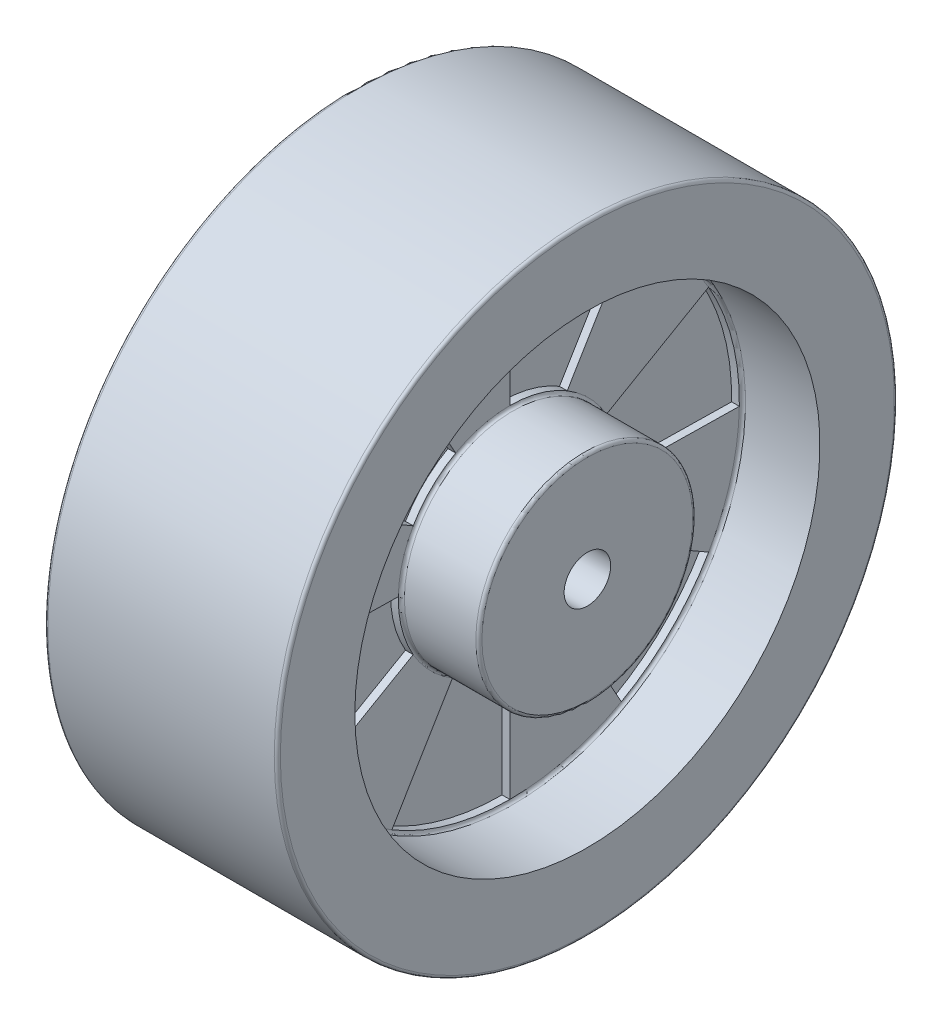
SolidWorks part; units mm, degrees
ref_plane "Front Plane" through (0, 0, 0) normal (0, 0, 1) x (1, 0, 0)
ref_plane "Top Plane" through (0, 0, 0) normal (0, 1, 0) x (1, 0, 0)
ref_plane "Right Plane" through (0, 0, 0) normal (1, 0, 0) x (0, 0, -1)
sketch "Sketch1" plane through (0, 0, 0) normal (0, 0, 1) x (1, 0, 0)
  line L0 (0, 0) -> (56.1842, 0) construction
  line L1 (-38.1, 7.62) -> (38.1, 7.62)
  line L2 (38.1, 7.62) -> (38.1, 35.56)
  line L3 (38.1, 35.56) -> (12.7, 35.56)
  line L4 (12.7, 35.56) -> (12.7, 76.2)
  line L5 (12.7, 76.2) -> (38.1, 76.2)
  line L6 (38.1, 76.2) -> (38.1, 101.6)
  line L7 (38.1, 101.6) -> (-38.1, 101.6)
  line L8 (-38.1, 101.6) -> (-38.1, 76.2)
  line L9 (-38.1, 76.2) -> (-12.7, 76.2)
  line L10 (-12.7, 76.2) -> (-12.7, 35.56)
  line L11 (-12.7, 35.56) -> (-38.1, 35.56)
  line L12 (-38.1, 35.56) -> (-38.1, 7.62)
  line L13 (0, 0) -> (0, 30.585) construction
  point P15 (0, 7.62)
  dimension "D1" = 7.62
  dimension "D2" = 35.56
  dimension "D3" = 76.2
  dimension "D4" = 101.6
  dimension "D5" = 76.2
  dimension "D6" = 25.4
revolve "Revolve1" add sketch "Sketch1" angle 360 about L0
fillet "Fillet1" radius 1 8 edges at (12.7, 0, 76.2) (12.7, 0, 35.56) (38.1, 0, 35.56) (-12.7, 0, 35.56) (-38.1, 0, 35.56) (-12.7, 0, 76.2) (38.1, 0, 101.6) (-38.1, 0, 101.6)
sketch "Sketch2" plane through (12.7, 0, 0) normal (1, 0, 0) x (0, 0, -1)
  line L0 (0, 34.56) -> (0, 76.2)
  line L1 (0, 76.2) -> (0, 34.56)
  line L2 (17.7731, 29.6397) -> (38.6729, 64.4938)
  circle A0 centre (0, 0) radius 76.2 construction
  circle A1 centre (0, 0) radius 75.2 construction
  arc A2 (17.7731, 29.6397) -> (0, 34.56) centre (0, 0) ccw
  arc A3 (38.6729, 64.4938) -> (0, 75.2) centre (0, 0) ccw
extrude "Cut-Extrude1" cut sketch "Sketch2" against normal blind 2.54 contours L2 L0 M3 M2
pattern_circular "CirPattern1" count 6 over 360 about axis through (0, 0, 0) along (1, 0, 0) of "Cut-Extrude1"
mirror "Mirror1" about plane through (0, 0, 0) normal (1, 0, 0) of "CirPattern1", "Cut-Extrude1"
